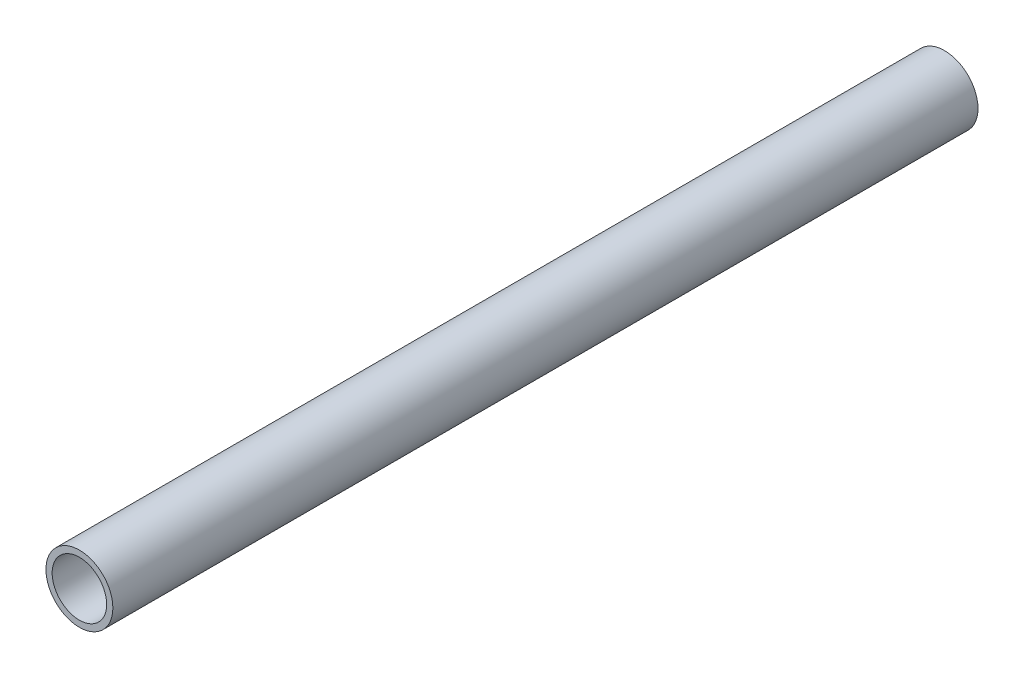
SolidWorks part; units mm, degrees
ref_plane "Front" through (0, 0, 0) normal (0, 0, 1) x (1, 0, 0)
ref_plane "Top" through (0, 0, 0) normal (0, 1, 0) x (1, 0, 0)
ref_plane "Right" through (0, 0, 0) normal (1, 0, 0) x (0, 0, -1)
sketch "Sketch1" plane through (0, 0, 0) normal (0, 0, 1) x (1, 0, 0)
  circle A0 centre (0, 0) radius 7.9375
  circle A1 centre (0, 0) radius 6.4643
  dimension "D1" = 15.875
  dimension "D2" = 1.4732
extrude "Base-Extrude" add sketch "Sketch1" against normal blind 205.232
